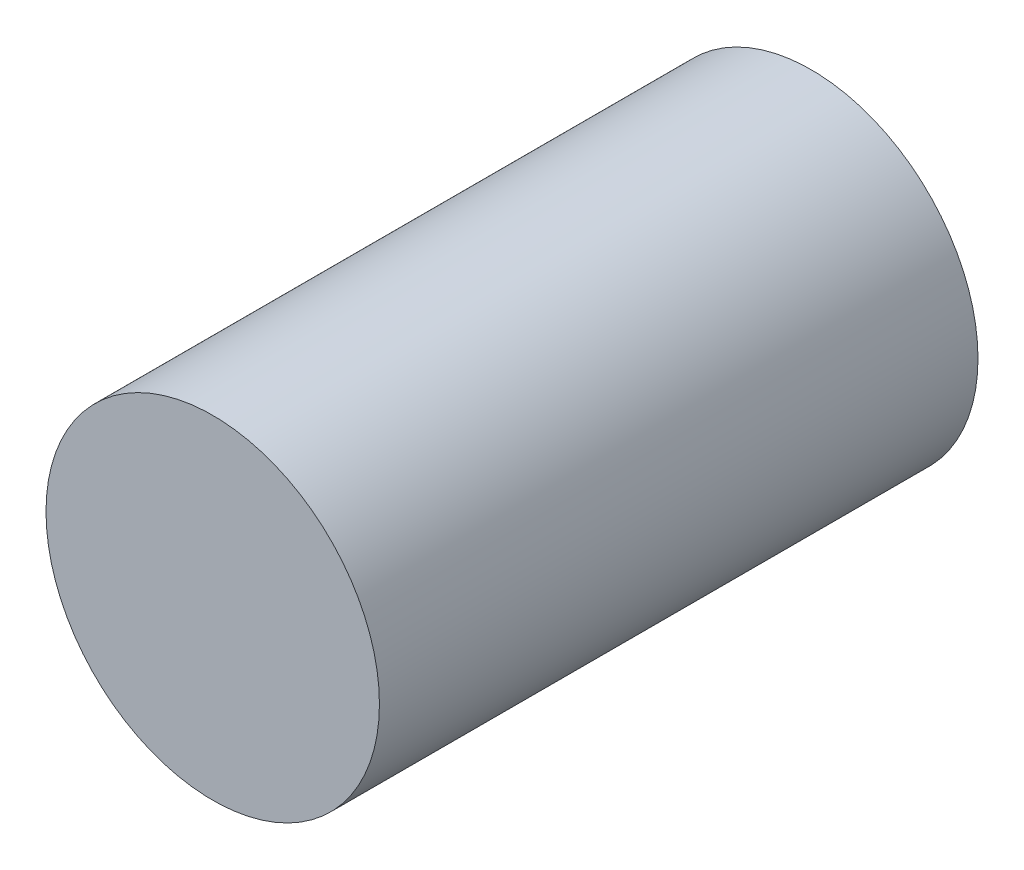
SolidWorks part; units mm, degrees
ref_plane "Front Plane" through (0, 0, 0) normal (0, 0, 1) x (1, 0, 0)
ref_plane "Top Plane" through (0, 0, 0) normal (0, 1, 0) x (1, 0, 0)
ref_plane "Right Plane" through (0, 0, 0) normal (1, 0, 0) x (0, 0, -1)
other "tool steel"
sketch "Sketch1" plane through (0, 0, 0) normal (0, 0, 1) x (1, 0, 0)
  circle A0 centre (0, 0) radius 5.207
  dimension "D1" = 10.414
extrude "Boss-Extrude1" add sketch "Sketch1" along normal blind 18.6944
